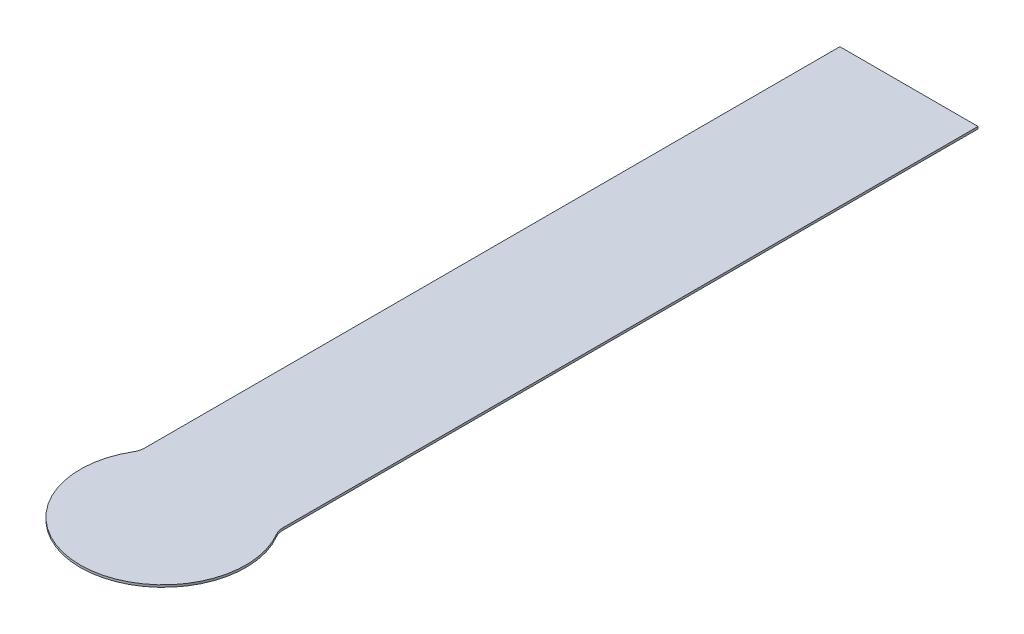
SolidWorks part; units mm, degrees
ref_plane "Front Plane" through (0, 0, 0) normal (0, 0, 1) x (1, 0, 0)
ref_plane "Top Plane" through (0, 0, 0) normal (0, 1, 0) x (1, 0, 0)
ref_plane "Right Plane" through (0, 0, 0) normal (1, 0, 0) x (0, 0, -1)
sketch "Sketch1" plane through (0, 0, 0) normal (0, 1, 0) x (1, 0, 0)
  line L0 (-3.175, 2.3383) -> (-3.175, 34.29)
  line L1 (3.175, 2.3383) -> (3.175, 34.29)
  line L2 (3.175, 34.29) -> (-3.175, 34.29)
  arc A0 (-3.2866, 1.9272) -> (3.2866, 1.9272) centre (0, 0) ccw
  arc A1 (-3.2866, 1.9272) -> (-3.175, 2.3383) centre (-3.9878, 2.3383) ccw
  arc A2 (-3.2866, 1.9272) -> (-3.175, 2.3383) centre (-3.9878, 2.3383) ccw
  arc A3 (3.175, 2.3383) -> (3.2866, 1.9272) centre (3.9878, 2.3383) ccw
extrude "Extrude1" add sketch "Sketch1" along normal blind 0.1016 contours A3 L1 L2 L0 A1 A0
